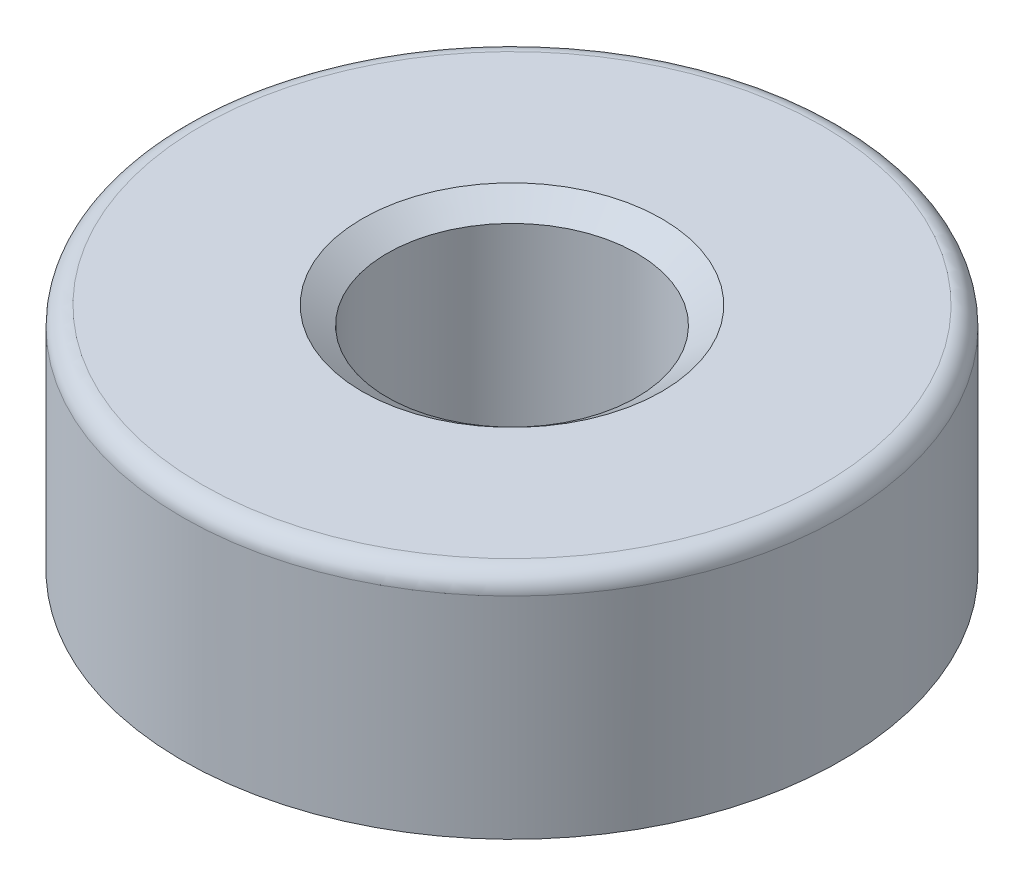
SolidWorks part; units mm, degrees
ref_plane "Plane1" through (0, 0, 0) normal (0, 0, 1) x (1, 0, 0)
ref_plane "Plane2" through (0, 0, 0) normal (0, 1, 0) x (1, 0, 0)
ref_plane "Plane3" through (0, 0, 0) normal (1, 0, 0) x (0, 0, -1)
sketch "BodySke" plane through (0, 0, 0) normal (0, 0, 1) x (1, 0, 0)
  line L0 (4.015, 0) -> (4.8758, 0)
  line L1 (6.6, 0) -> (6.6, 4.219)
  line L2 (6.219, 4.6) -> (2.5, 4.6)
  line L3 (2.5, 4.6) -> (2.5, -1.24)
  line L4 (2.5, -1.24) -> (4.015, -1.24)
  line L5 (4.015, -1.24) -> (4.015, 0)
  line L6 (6.6, 0) -> (5.7392, -0.62)
  line L7 (1.016, 1) -> (3.6522, 1) construction
  line L8 (5.7392, -0.62) -> (4.8758, 0)
  line L9 (0, 0) -> (0, 15.24) construction
  arc A0 (6.6, 4.219) -> (6.219, 4.6) centre (6.219, 4.219) ccw
  point P14 (6.6, 4.6)
  dimension "D1" = 0.381
  dimension "E_dia" = 13.2
  dimension "C_dia" = 8.03
  dimension "A_ht" = 1.24
  dimension "T_ht" = 4.6
  dimension "Thread_min" = 5
  dimension "Advance" = 1
  dimension "Lug_minor_dia" = 9.7516
  dimension "Lug_tip_dia" = 11.4784
  dimension "Lug_ht" = 0.62
revolve "Body" add sketch "BodySke"
revolve "EndChamfer" cut sketch "EndChamferSke" angle 360 about L0
sketch "EndChamferSke" plane through (0, 0, 0) normal (0, 0, 1) x (1, 0, 0)
  line L0 (0, -2.54) -> (0, 7.62) construction
  line L1 (0, 0) -> (0, 15.24) construction
  line L2 (3, -1.494) -> (3, -0.986)
  line L3 (3, -0.986) -> (2.5, -0.636)
  line L4 (2.5, -0.636) -> (2.5, -1.494)
  line L5 (2.5, -1.494) -> (3, -1.494)
  line L6 (3, 4.6) -> (2.5, 4.25)
  line L8 (2.5, 4.25) -> (2.5, 4.6)
  line L9 (3, 4.6) -> (2.5, 4.6)
  line L10 (2.5, 4.6) -> (-2.5, 4.6) construction
  line L11 (-4.015, -1.24) -> (4.015, -1.24) construction
  dimension "D1" = 0.254
  dimension "Thread_nominal" = 6
  dimension "D2" = 34.99
  dimension "Thread_min" = 5
  dimension "Inset" = 0.254
ref_plane "Plane4" through (0, -0.5486, 0) normal (0, 1, 0) x (-1, 0, 0)
sketch "ThdSchSke" plane through (0, 0, 0) normal (0, 0, 1) x (1, 0, 0)
  line L0 (0, -5.08) -> (0, 7.62) construction
  line L1 (0, 0) -> (0, 15.24) construction
  line L2 (0, -0.986) -> (3, -0.986) construction
  line L4 (3, -0.986) -> (2.5, -0.6359)
  line L6 (3, -0.986) -> (2.5, -1.3361)
  line L7 (2.5, -0.6359) -> (2.5, -1.3361)
  line L8 (3, -0.986) -> (-3, -0.986) construction
  dimension "Vee_angle" = 70
  dimension "Thread_nominal" = 6
  dimension "Thread_min" = 5
revolve "ThreadSchematic" [suppressed] cut sketch "ThdSchSke" angle 360 about L0
pattern_linear "ThdSchPat" [suppressed]
sketch "LugGapSke" plane through (0, 0, 0) normal (0, 1, 0) x (1, 0, 0)
  line L0 (-1.0206, -4.7678) -> (-1.9146, -6.3162)
  line L1 (4.6393, -1.5) -> (6.4273, -1.5)
  line L2 (0, 0) -> (-3.8626, -6.6901) construction
  line L3 (0, 0) -> (7.366, 0) construction
  arc A0 (-1.9146, -6.3162) -> (6.4273, -1.5) centre (0, 0) ccw
  arc A1 (-1.0206, -4.7678) -> (4.6393, -1.5) centre (0, 0) ccw
  circle A2 centre (0, 0) radius 4.8758 construction
  circle A3 centre (0, 0) radius 6.6 construction
  dimension "Depth" = 120
  dimension "Lug_wid1" = 3
  dimension "Lug_wid2" = 3
extrude "LugGap" cut sketch "LugGapSke" against normal blind 6.35
pattern_circular "LugGapPat" count 3 every 120 about axis through (0, 0, 0) along (0, 1, 0) of "LugGap"
equation "' \"A_ht@BodySke\" = 1.24"
equation "' \"C_dia@BodySke\" = 8.03"
equation "' \"E_dia@BodySke\" = 13.2"
equation "' \"T_ht@BodySke\" = 4.6"
equation "' \"Advance@BodySke\" = 1"
equation "' \"Thread_min@BodySke\" = 5"
equation "' \"Thread_nominal@ThreadCosmetic\" = 6"
equation "\"Lug_ht@BodySke\" = \"A_ht@BodySke\" / 2"
equation "\"Lug_tip_dia@BodySke\" = \"C_dia@BodySke\" + (\"E_dia@BodySke\" - \"C_dia@BodySke\" ) * 0.667"
equation "\"Lug_minor_dia@BodySke\" = \"C_dia@BodySke\" + (\"E_dia@BodySke\" - \"C_dia@BodySke\" ) * 0.333"
equation "\"Lug_wid1@LugGapSke\" = \"Thread_nominal@ThreadCosmetic\" * 0.5"
equation "\"Lug_wid2@LugGapSke\" = \"Lug_wid1@LugGapSke\""
equation "\"Thread_nominal@EndChamferSke\" = \"Thread_nominal@ThreadCosmetic\""
equation "\"Thread_min@EndChamferSke\" = \"Thread_min@BodySke\""
equation "\"D2@EndChamferSke\" = \"Vee_angle@ThdSchSke\" / 2 - 0.01"
equation "\"Thread_nominal@ThdSchSke\" = \"Thread_nominal@ThreadCosmetic\""
equation "\"Thread_min@ThdSchSke\" = \"Thread_min@BodySke\""
equation "\"Num_threads@ThdSchPat\" = int(  ( \"A_ht@BodySke\" + \"T_ht@BodySke\" - \"Inset@EndChamferSke\" ) / \"Advance@BodySke\" + 0.999 )  + 1"
equation "\"Advance@ThdSchPat\" = (  \"A_ht@BodySke\" + \"T_ht@BodySke\" - \"Inset@EndChamferSke\"  ) /  (\"Num_threads@ThdSchPat\" - 1) 'relax it"
